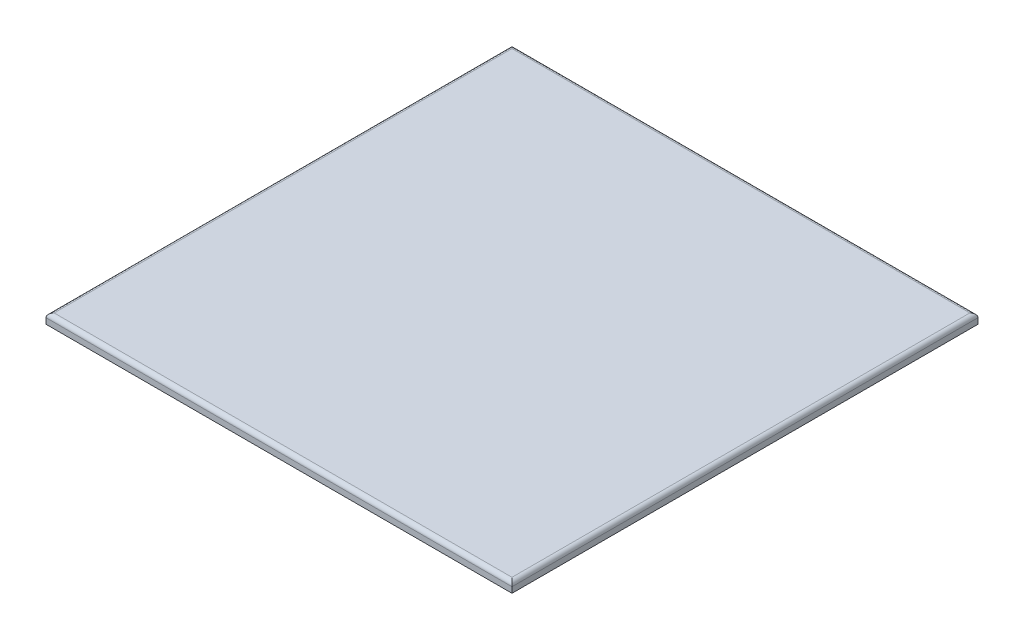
SolidWorks part; units mm, degrees
ref_plane "Front Plane" through (0, 0, 0) normal (0, 0, 1) x (1, 0, 0)
ref_plane "Top Plane" through (0, 0, 0) normal (0, 1, 0) x (1, 0, 0)
ref_plane "Right Plane" through (0, 0, 0) normal (1, 0, 0) x (0, 0, -1)
sketch "Sketch2" plane through (0, 0, 0) normal (0, 1, 0) x (1, 0, 0)
  line L1 (0, 0) -> (145, 0)
  line L2 (0, 0) -> (0, 145)
  line L3 (0, 145) -> (145, 145)
  line L4 (145, 0) -> (145, 145)
  dimension "D1" = 145
  dimension "D2" = 145
extrude "Boss-Extrude1" add sketch "Sketch2" along normal blind 3.048
fillet "Fillet1" radius 1.27 4 edges at (72.5, 3.048, 0) (145, 3.048, -72.5) (72.5, 3.048, -145) (0, 3.048, -72.5)
